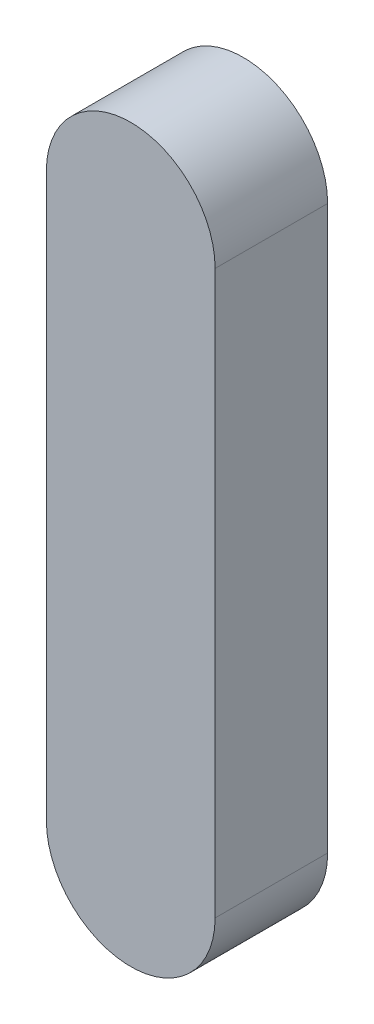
SolidWorks part; units mm, degrees
ref_plane "前视基准面" through (0, 0, 0) normal (0, 0, 1) x (1, 0, 0)
ref_plane "上视基准面" through (0, 0, 0) normal (0, 1, 0) x (1, 0, 0)
ref_plane "右视基准面" through (0, 0, 0) normal (1, 0, 0) x (0, 0, -1)
sketch "草图1" plane through (0, 0, 0) normal (0, 0, 1) x (1, 0, 0)
  line L0 (7.5, -56) -> (7.5, -36) construction
  line L1 (1.5, -36) -> (1.5, -56) construction
  line L2 (7.5, -56) -> (7.5, -36)
  line L3 (1.5, -36) -> (1.5, -56)
  arc A0 (7.5, -36) -> (1.5, -36) centre (4.5, -36) ccw construction
  arc A1 (1.5, -56) -> (7.5, -56) centre (4.5, -56) ccw construction
  arc A2 (7.5, -36) -> (1.5, -36) centre (4.5, -36) ccw
  arc A3 (1.5, -56) -> (7.5, -56) centre (4.5, -56) ccw
extrude "拉伸1" add sketch "草图1" along normal blind 4
